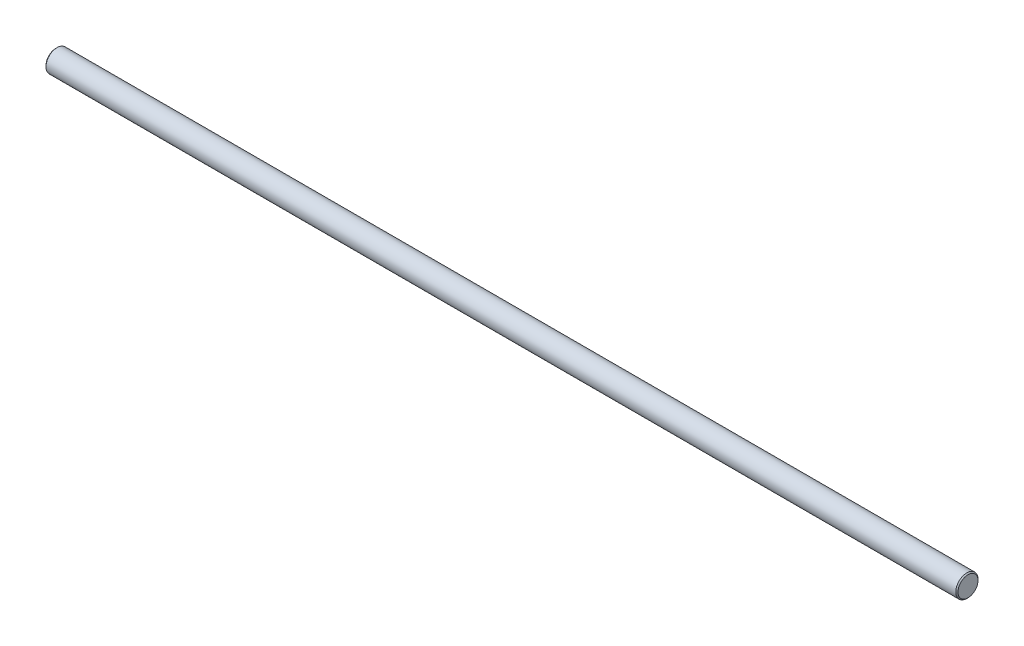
SolidWorks part; units mm, degrees
ref_plane "Front Plane" through (0, 0, 0) normal (0, 0, 1) x (1, 0, 0)
ref_plane "Top Plane" through (0, 0, 0) normal (0, 1, 0) x (1, 0, 0)
ref_plane "Right Plane" through (0, 0, 0) normal (1, 0, 0) x (0, 0, -1)
ref_plane "Plane1" through (0, 0, 0) normal (0, 0, 1) x (1, 0, 0)
sketch "Sketch1" plane through (0, 0, 0) normal (0, 0, 1) x (1, 0, 0)
  line L0 (0, 0) -> (0, 4.5)
  line L1 (0, 4.5) -> (0.5, 5)
  line L2 (0.5, 5) -> (409.5, 5)
  line L3 (409.5, 5) -> (410, 4.5)
  line L4 (410, 4.5) -> (410, 0)
  line L5 (410, 0) -> (0, 0)
  line L6 (410, 0) -> (0, 0) construction
  dimension "D1" = 410
  dimension "D2" = 5
  dimension "D3" = 4.5
  dimension "D4" = 0.5
  dimension "D5" = 4.5
  dimension "D6" = 0.5
revolve "Revolve1" add sketch "Sketch1" angle 360 about L6
